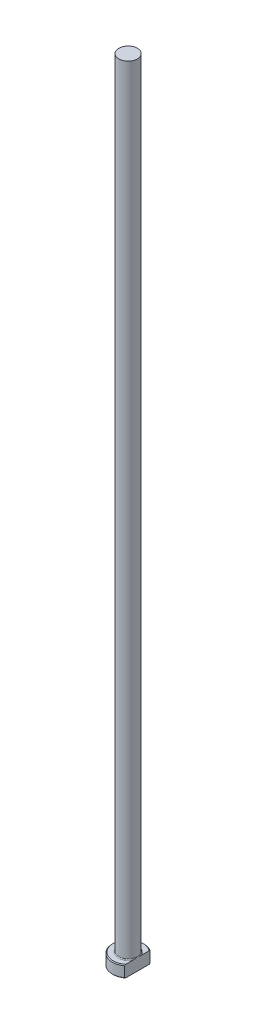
SolidWorks part; units mm, degrees
ref_plane "Front Plane" through (0, 0, 0) normal (0, 0, 1) x (1, 0, 0)
ref_plane "Top Plane" through (0, 0, 0) normal (0, 1, 0) x (1, 0, 0)
ref_plane "Right Plane" through (0, 0, 0) normal (1, 0, 0) x (0, 0, -1)
sketch "Sketch1" plane through (0, 0, 0) normal (0, 0, 1) x (1, 0, 0)
  line L0 (0, 259.9588) -> (0, -15.1925) construction
  line L1 (0, 0) -> (-4, 0)
  line L2 (-4, 0) -> (-4, 3)
  line L3 (-4, 3) -> (-2.35, 3)
  line L4 (-2.35, 3) -> (-2.35, 200)
  line L5 (-2.35, 200) -> (0, 200)
  line L6 (0, 200) -> (0, 0)
  dimension "L" = 200
  dimension "H" = 8
  dimension "T" = 3
  dimension "D" = 4.7
revolve "Revolve1" add sketch "Sketch1" angle 360 about L0
chamfer "Chamfer1" distance 0.2 angle 45 2 edges at (0, 3, 4) (0, 0, 4)
fillet "Fillet1" radius 0.2 1 edges at (0, 3, 2.35)
sketch "Sketch2" plane through (0, 0, 0) normal (0, 1, 0) x (1, 0, 0)
  line L0 (2.35, 3.2369) -> (2.35, -3.2369)
  circle A0 centre (0, 0) radius 4 construction
  arc A1 (2.35, -3.2369) -> (2.35, 3.2369) centre (0, 0) ccw
  circle A2 centre (0, 0) radius 2.35 construction
extrude "KEY" cut sketch "Sketch2" along normal through all
